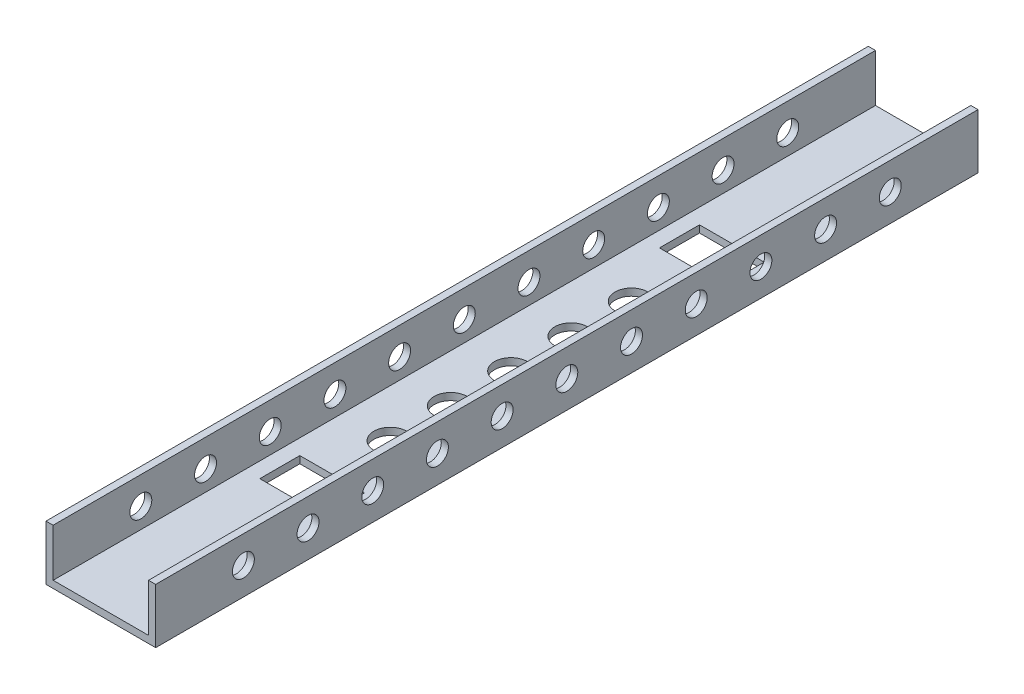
SolidWorks part; units mm, degrees
ref_plane "Front Plane" through (0, 0, 0) normal (0, 0, 1) x (1, 0, 0)
ref_plane "Top Plane" through (0, 0, 0) normal (0, 1, 0) x (1, 0, 0)
ref_plane "Right Plane" through (0, 0, 0) normal (1, 0, 0) x (0, 0, -1)
sketch "Sketch2" plane through (0, 0, 0) normal (0, 0, 1) x (1, 0, 0)
  line L0 (-22.9308, -18.8107) -> (-22.9308, 6.5893)
  line L1 (-22.9308, 6.5893) -> (-19.6288, 6.5893)
  line L2 (-19.6288, 6.5893) -> (-19.6288, -15.5087)
  line L3 (-19.6288, -15.5087) -> (24.5672, -15.5087)
  line L4 (27.8692, 6.5893) -> (24.5672, 6.5893)
  line L5 (24.5672, 6.5893) -> (24.5672, -15.5087)
  line L6 (27.8692, 6.5893) -> (27.8692, -18.8107)
  line L7 (-22.9308, -18.8107) -> (27.8692, -18.8107)
  dimension "D1" = 50.8
  dimension "D3" = 25.4
  dimension "D4" = 3.302
  dimension "D5" = 3.302
  dimension "D6" = 25.4
  dimension "0.13" = 3.302
extrude "Boss-Extrude1" add sketch "Sketch2" along normal blind 381
sketch "Sketch3" plane through (27.8692, 0, 0) normal (1, 0, 0) x (0, 0, -1)
  circle A0 centre (-190.5, -6.1107) radius 5.08
  dimension "D1" = 10.16
extrude "Cut-Extrude1" cut sketch "Sketch3" against normal blind 71.12
sketch "Sketch4" plane through (27.8692, 0, 0) normal (1, 0, 0) x (0, 0, -1)
  line L1 (0, -18.8107) -> (0, 6.5893) construction
  line L2 (-381, 6.5893) -> (-381, -15.5087) construction
  circle A0 centre (-220.472, -6.1107) radius 5.08
  circle A1 centre (-250.444, -6.1107) radius 5.08
  circle A2 centre (-280.416, -6.1107) radius 5.08
  circle A3 centre (-310.388, -6.1107) radius 5.08
  circle A4 centre (-340.36, -6.1107) radius 5.08
  circle A5 centre (-160.528, -6.1107) radius 5.08
  circle A6 centre (-130.556, -6.1107) radius 5.08
  circle A7 centre (-100.584, -6.1107) radius 5.08
  circle A8 centre (-70.612, -6.1107) radius 5.08
  circle A9 centre (-40.64, -6.1107) radius 5.08
  circle A11 centre (-190.5, -6.1107) radius 5.08 construction
  dimension "D1" = 10.16
  dimension "D2" = 10.16
  dimension "D3" = 10.16
  dimension "D4" = 10.16
  dimension "D5" = 10.16
  dimension "D6" = 10.16
  dimension "D7" = 10.16
  dimension "D8" = 10.16
  dimension "D9" = 10.16
  dimension "D10" = 10.16
  dimension "D11" = 40.64
  dimension "D12" = 29.972
  dimension "D17" = 29.972
  dimension "D13" = 29.972
  dimension "D14" = 29.972
  dimension "D15" = 29.972
  dimension "D16" = 29.972
  dimension "D18" = 29.972
  dimension "D19" = 29.972
  dimension "D20" = 29.972
  dimension "D21" = 29.972
extrude "Cut-Extrude2" cut sketch "Sketch4" against normal blind 88.9
sketch "Sketch5" plane through (0, -15.5087, 0) normal (0, 1, 0) x (1, 0, 0)
  line L0 (-68.312, -88.646) -> (87.952, -88.646) construction
  line L2 (24.5672, -381) -> (24.5672, 0) construction
  line L3 (-12.5168, -88.646) -> (17.4552, -88.646)
  line L4 (-12.5168, -88.646) -> (-12.5168, -107.188)
  line L5 (-12.5168, -107.188) -> (17.4552, -107.188)
  line L6 (17.4552, -88.646) -> (17.4552, -107.188)
  line L7 (24.5672, 0) -> (-19.6288, 0) construction
  dimension "D1" = 107.188
  dimension "D2" = 29.972
  dimension "D3" = 18.542
  dimension "D4" = 7.112
extrude "Cut-Extrude3" cut sketch "Sketch5" against normal blind 88.9
sketch "Sketch6" plane through (0, -15.5087, 0) normal (0, 1, 0) x (1, 0, 0)
  line L0 (67.3187, -292.354) -> (-64.2233, -292.354) construction
  line L2 (24.5672, -381) -> (24.5672, 0) construction
  line L3 (-12.5168, -292.354) -> (17.4552, -292.354)
  line L4 (-12.5168, -292.354) -> (-12.5168, -273.812)
  line L5 (-12.5168, -273.812) -> (17.4552, -273.812)
  line L6 (17.4552, -292.354) -> (17.4552, -273.812)
  line L7 (24.5672, -381) -> (-19.6288, -381) construction
  point P2 (2.4692, -381)
  dimension "D1" = 107.188
  dimension "D2" = 18.542
  dimension "D3" = 29.972
  dimension "D4" = 7.112
extrude "Cut-Extrude4" cut sketch "Sketch6" against normal blind 88.9
sketch "Sketch8" plane through (0, -15.5087, 0) normal (0, 1, 0) x (1, 0, 0)
  line L0 (-12.5168, -107.188) -> (17.4552, -107.188) construction
  circle A0 centre (2.4692, -135.128) radius 7.62
  circle A1 centre (2.4692, -163.068) radius 7.62
  circle A2 centre (2.4692, -191.008) radius 7.62
  circle A3 centre (2.4692, -218.948) radius 7.62
  circle A4 centre (2.4692, -246.888) radius 7.62
  dimension "D1" = 15.24
  dimension "D2" = 15.24
  dimension "D3" = 15.24
  dimension "D4" = 15.24
  dimension "D9" = 15.24
  dimension "D5" = 27.94
  dimension "D6" = 27.94
  dimension "D7" = 27.94
  dimension "D8" = 27.94
  dimension "D10" = 27.94
extrude "Cut-Extrude6" cut sketch "Sketch8" against normal blind 24.638
